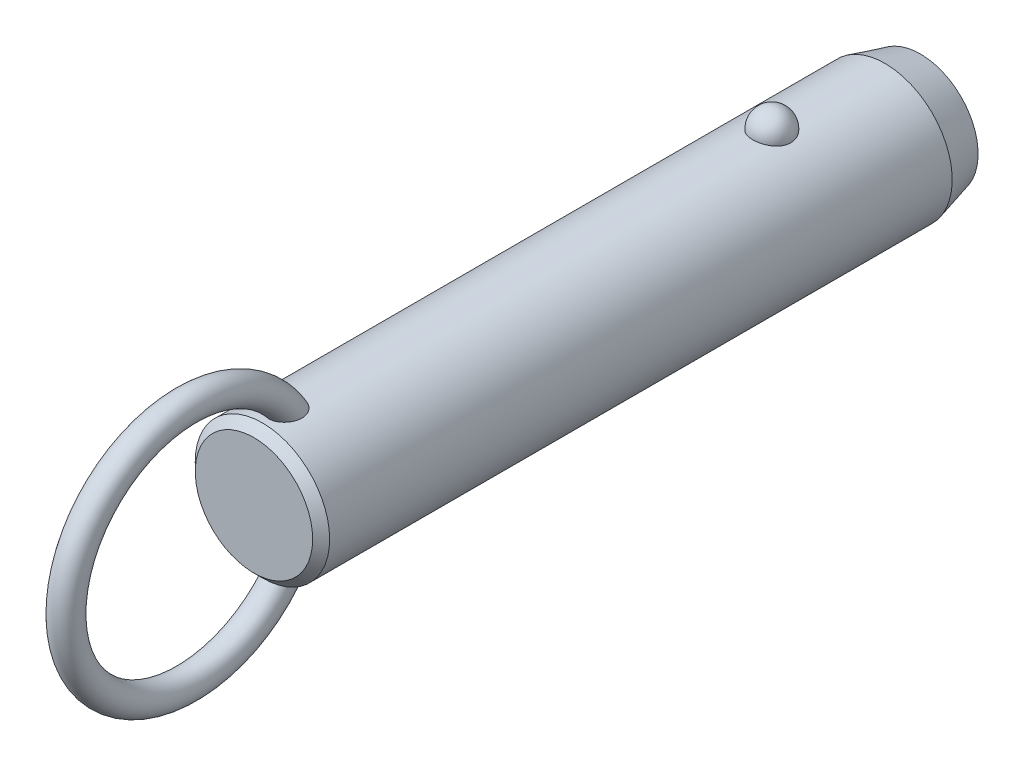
SolidWorks part; units mm, degrees
ref_plane "Front Plane" through (0, 0, 0) normal (0, 0, 1) x (1, 0, 0)
ref_plane "Top Plane" through (0, 0, 0) normal (0, 1, 0) x (1, 0, 0)
ref_plane "Right Plane" through (0, 0, 0) normal (1, 0, 0) x (0, 0, -1)
sketch "Sketch2" plane through (0, 0, 0) normal (0, 0, 1) x (1, 0, 0)
  circle A0 centre (0, 0) radius 9.5
  point P3 (0, 9.5)
  dimension "D1" = 19
extrude "Boss-Extrude1" add sketch "Sketch2" along normal blind 61
sketch "Sketch3" plane through (0, 0, 0) normal (0, 0, -1) x (-1, 0, 0)
  circle A0 centre (0, 0) radius 9.5
  dimension "D1" = 19
extrude "Boss-Extrude2" add sketch "Sketch3" along normal blind 23.7
chamfer "Chamfer1" distance 5 angle 15 1 edges at (-9.5, 0, -23.7)
sketch "Sketch12" plane through (0, 0, 0) normal (1, 0, 0) x (0, 0, -1)
  line L0 (-61, 9.5) -> (-61, -9.5) construction
  point P0 (-61, 0)
sketch "Sketch13" plane through (0, 0, 0) normal (1, 0, 0) x (0, 0, -1)
  circle A0 centre (-80.05, 0) radius 19.05
  point P2 (-61, 0)
  dimension "D1" = 38.1
sketch "Sketch14" plane through (0, 0, 0) normal (0, 1, 0) x (1, 0, 0)
  circle A0 centre (0, -63) radius 2
  point P2 (0, -61)
  dimension "D1" = 4
sweep "Sweep1" add profiles "Sketch14" path "Sketch13"
sketch "Sketch15" plane through (0, 0, 61) normal (0, 0, 1) x (1, 0, 0)
  circle A0 centre (0, 0) radius 9.5
  dimension "D1" = 19
extrude "Boss-Extrude3" add sketch "Sketch15" along normal blind 9.52
chamfer "Chamfer2" distance 1.2 angle 45 1 edges at (9.5, 0, 70.52)
sketch "Sketch18" plane through (0, 0, 0) normal (1, 0, 0) x (0, 0, -1)
  line L0 (18.7, 9.5) -> (-63.5378, 9.5) construction
  line L1 (2.7, 12.2) -> (2.7, 6.8)
  line L2 (-63.5378, -9.5) -> (18.7, -9.5) construction
  arc A0 (2.7, 12.2) -> (2.7, 6.8) centre (2.7, 9.5) ccw
  point P4 (0, 9.5)
  dimension "D1" = 21.7
revolve "Revolve1" add sketch "Sketch18" angle 360 about L1
